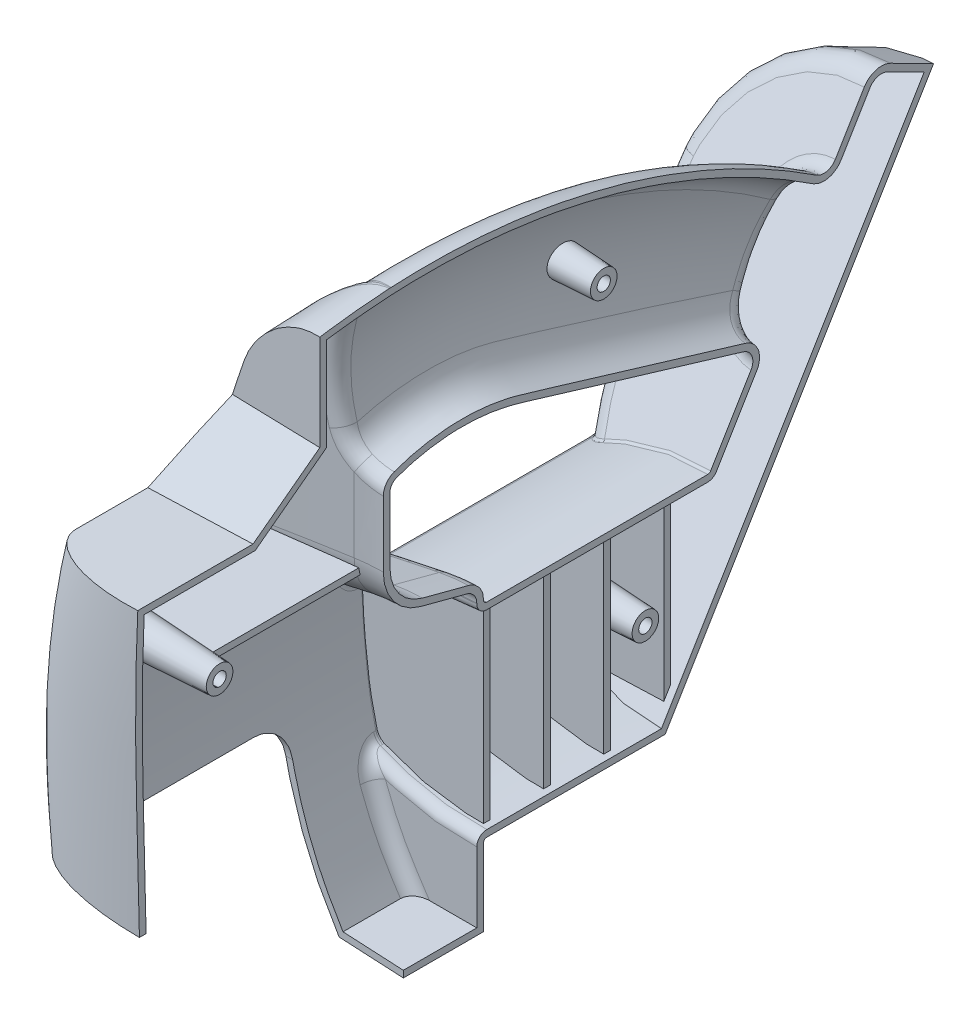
SolidWorks part; units mm, degrees
ref_plane "Front" through (0, 0, 0) normal (0, 0, 1) x (1, 0, 0)
ref_plane "Top" through (0, 0, 0) normal (0, 1, 0) x (1, 0, 0)
ref_plane "Right" through (0, 0, 0) normal (1, 0, 0) x (0, 0, -1)
imported_body "Imported_STEP"
sketch "Sketch1" plane through (0, 0, 0) normal (1, 0, 0) x (0, 0, -1)
  line L0 (-4.4961, 135) -> (30, 135)
  line L1 (30, 135) -> (50, 150)
  line L2 (50, 150) -> (50, 178.6585)
  point P2 (-2.8305, 160)
  point P3 (0, 0)
  point P6 (70.9971, 180.8687)
  point P7 (9, 167.9021)
other "AlignGroup1" parameters "D1"=0, "D2"=30, "D3"=50, "D4"=0, "D5"=135, "D6"=150
other "AlignGroup2"
extrude "upper cut" cut sketch "Sketch1" against normal through all and the other way through all
sketch "Sketch2" plane through (0, 0, 0) normal (1, 0, 0) x (0, 0, -1)
  line L0 (-4.0084, 50) -> (65, 50)
  line L1 (75, 40) -> (75, 0)
  line L2 (0, 0) -> (98.9859, 0) construction
  arc A0 (65, 50) -> (75, 40) centre (65, 40) cw
  point P2 (-4.4961, 135)
  point P3 (0, 0)
  dimension "D1" = 10
  dimension "D2" = 75
  dimension "D3" = 50
extrude "lower cut" cut sketch "Sketch2" against normal through all and the other way through all flip side to cut
draft "Draft1" type of draft neutral plane draft angle 3 faces to draft 8 parameters "D1"=3
fillet "Fillet1" radius 6 2 edges at (-27.8619, 156.9497, -211.6616) (-41.5631, 105.0086, -181.29)
fillet "Fillet2" radius 4 3 edges at (-7.3242, 141.5342, -201.1434) (-7.4173, 112.1477, -183.4919) (-12.3891, 128.043, -193.3467)
fillet "Fillet3" radius 3 5 edges at (-5.033, 179.7342, -70.7495) (-9.5785, 176.0772, -70.1084) (-4.3388, 130.7035, -70.8132) (-11.0489, 136.0477, -69.861) (-13.5744, 164.0748, -69.4289)
fillet "Fillet4" radius 5 6 edges at (-4.7101, 180.1183, -70.7803) (-22.9586, 162.3716, -67.7418) (-37.8637, 96.426, -68.8458)
fillet "Fillet5" radius 1 5 edges at (-33.1385, 77.7124, -165.6182) (-17.3408, 26.2892, -98.0771) (-19.8968, 82.4402, -97.9432) (-15.2362, 83.5011, -166.7573)
fillet "Fillet6" radius 6 12 edges at (-4.1966, 90.7045, -98.766) (-21.4703, 88.0401, -97.8607) (-37.3584, 83.9019, -97.028) (-38.5216, 75.3159, -97.2404) (-33.4468, 32.8297, -97.7285)
sketch "Sketch3" plane through (0, 0, 0) normal (1, 0, 0) x (0, 0, -1)
  line L0 (147.4592, 65.0489) -> (147.4592, 45.098) construction
  circle A0 centre (147.4592, 55.0734) radius 2
  circle A1 centre (135, 150) radius 2
  circle A2 centre (20, 105) radius 2
other "AlignGroup3" parameters "D7"=19.6563, "D1"=0, "D2"=20, "D3"=135, "D4"=0, "D5"=105, "D6"=150
other "AlignGroup4"
extrude "Stand Offs" cut sketch "Sketch3" against normal up to next draft 3
shell "Shell2" thickness 2
ref_plane "thru standoff" through (0, 105, 0) normal (0, 1, 0) x (-1, 0, 0)
sketch "Sketch4" plane through (0, 105, 0) normal (0, 1, 0) x (-1, 0, 0)
  line L0 (7, -27.5655) -> (7, -57.8888)
  line L1 (0, -52.0027) -> (0, -30.6676) construction
  dimension "D1" = 7
rib "Rib1" sketch "Sketch4" sketch "Sketch4" thickness 2 extrusion direction parallel to sketch draft on yes draft angle 3 parameters "D1"=2, "D3"=3
ref_plane "Plane2" through (-2, 0, 0) normal (1, 0, 0) x (0, 0, -1)
sketch "Sketch5" plane through (-2, 0, 0) normal (1, 0, 0) x (0, 0, -1)
  line L0 (101.9859, 77.1571) -> (101.9859, 29.3013)
  line L1 (98.9859, 0) -> (98.9859, 23) construction
  line L2 (119.9859, 77.1571) -> (119.9859, 29.3013)
  line L3 (137.9859, 77.1571) -> (137.9859, 29.3013)
  line L4 (155.9859, 77.1571) -> (155.9859, 29.3013)
  line L5 (101.9859, 77.1571) -> (119.9859, 77.1571) construction
  dimension "D1" = 3
  dimension "D2" = 18
rib "Rib2" sketch "Sketch5" sketch "Sketch5" thickness 2 extrusion direction normal to sketch draft on yes draft angle 3 parameters "D1"=2, "D3"=3
